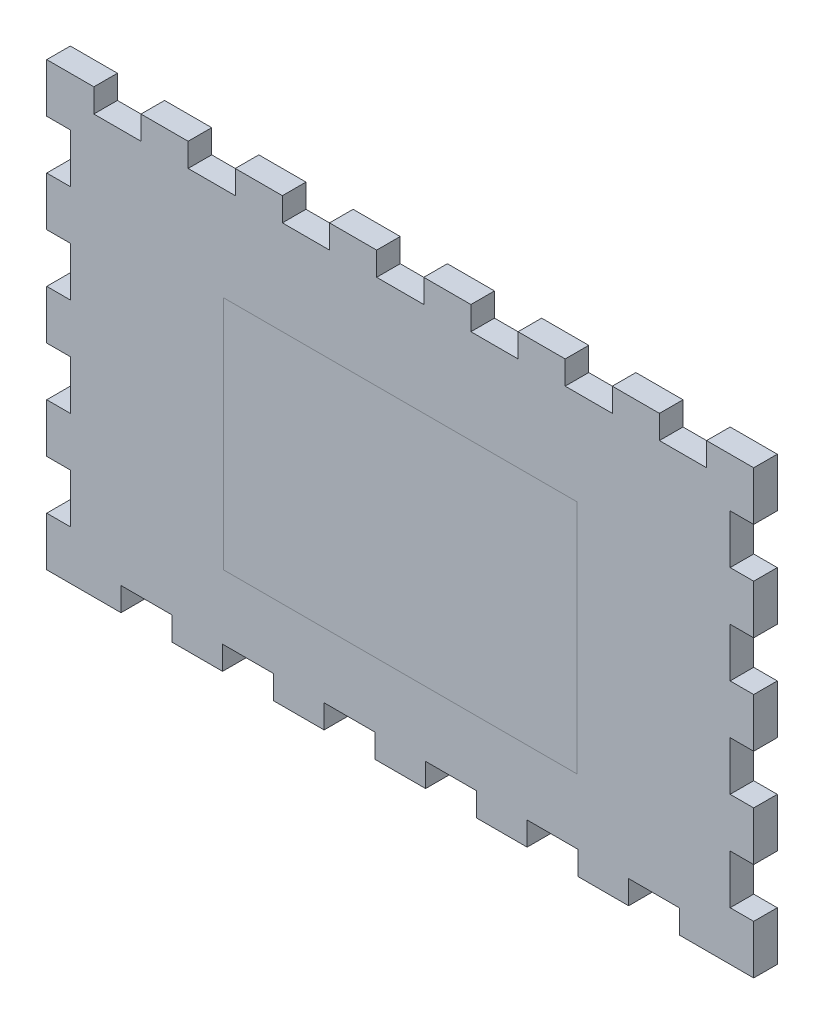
SolidWorks part; units mm, degrees
ref_plane "Front Plane" through (0, 0, 0) normal (0, 0, 1) x (1, 0, 0)
ref_plane "Top Plane" through (0, 0, 0) normal (0, 1, 0) x (1, 0, 0)
ref_plane "Right Plane" through (0, 0, 0) normal (1, 0, 0) x (0, 0, -1)
sketch "Model" plane through (0, 0, 0) normal (0, 0, 1) x (1, 0, 0)
  line L0 (83, 83) -> (87, 83)
  line L1 (87, 83) -> (87, 79)
  line L2 (87, 79) -> (95, 79)
  line L3 (95, 79) -> (95, 83)
  line L4 (95, 83) -> (103, 83)
  line L5 (103, 83) -> (103, 79)
  line L6 (103, 79) -> (111, 79)
  line L7 (111, 79) -> (111, 83)
  line L8 (111, 83) -> (119, 83)
  line L9 (119, 83) -> (119, 79)
  line L10 (119, 79) -> (127, 79)
  line L11 (127, 79) -> (127, 83)
  line L12 (127, 83) -> (135, 83)
  line L13 (135, 83) -> (135, 79)
  line L14 (135, 79) -> (143, 79)
  line L15 (143, 79) -> (143, 83)
  line L16 (143, 83) -> (151, 83)
  line L17 (151, 83) -> (151, 79)
  line L18 (151, 79) -> (159, 79)
  line L19 (159, 79) -> (159, 83)
  line L20 (159, 83) -> (167, 83)
  line L21 (167, 83) -> (167, 79)
  line L22 (167, 79) -> (175, 79)
  line L23 (175, 79) -> (175, 83)
  line L24 (175, 83) -> (183, 83)
  line L25 (183, 83) -> (183, 79)
  line L26 (183, 79) -> (191, 79)
  line L27 (191, 79) -> (191, 83)
  line L28 (191, 83) -> (195, 83)
  line L29 (195, 83) -> (195, 91.61)
  line L30 (195, 91.61) -> (199, 91.61)
  line L31 (199, 91.61) -> (199, 100.23)
  line L32 (199, 100.23) -> (195, 100.23)
  line L33 (195, 100.23) -> (195, 108.85)
  line L34 (195, 108.85) -> (199, 108.85)
  line L35 (199, 108.85) -> (199, 117.46)
  line L36 (199, 117.46) -> (195, 117.46)
  line L37 (195, 117.46) -> (195, 126.08)
  line L38 (195, 126.08) -> (199, 126.08)
  line L39 (199, 126.08) -> (199, 134.69)
  line L40 (199, 134.69) -> (195, 134.69)
  line L41 (195, 134.69) -> (195, 143.31)
  line L42 (195, 143.31) -> (199, 143.31)
  line L43 (199, 143.31) -> (199, 151.92)
  line L44 (199, 151.92) -> (195, 151.92)
  line L45 (195, 151.92) -> (195, 160.54)
  line L46 (195, 160.54) -> (199, 160.54)
  line L47 (199, 160.54) -> (199, 169.15)
  line L48 (199, 169.15) -> (195, 169.15)
  line L49 (195, 169.15) -> (195, 177.77)
  line L50 (195, 177.77) -> (199, 177.77)
  line L51 (199, 177.77) -> (199, 186.38)
  line L52 (199, 186.38) -> (195, 186.38)
  line L53 (195, 186.38) -> (195, 195)
  line L54 (195, 195) -> (191, 195)
  line L55 (191, 195) -> (191, 199)
  line L56 (191, 199) -> (183, 199)
  line L57 (183, 199) -> (183, 195)
  line L58 (183, 195) -> (175, 195)
  line L59 (175, 195) -> (175, 199)
  line L60 (175, 199) -> (167, 199)
  line L61 (167, 199) -> (167, 195)
  line L62 (167, 195) -> (159, 195)
  line L63 (159, 195) -> (159, 199)
  line L64 (159, 199) -> (151, 199)
  line L65 (151, 199) -> (151, 195)
  line L66 (151, 195) -> (143, 195)
  line L67 (143, 195) -> (143, 199)
  line L68 (143, 199) -> (135, 199)
  line L69 (135, 199) -> (135, 195)
  line L70 (135, 195) -> (127, 195)
  line L71 (127, 195) -> (127, 199)
  line L72 (127, 199) -> (119, 199)
  line L73 (119, 199) -> (119, 195)
  line L74 (119, 195) -> (111, 195)
  line L75 (111, 195) -> (111, 199)
  line L76 (111, 199) -> (103, 199)
  line L77 (103, 199) -> (103, 195)
  line L78 (103, 195) -> (95, 195)
  line L79 (95, 195) -> (95, 199)
  line L80 (95, 199) -> (87, 199)
  line L81 (87, 199) -> (87, 195)
  line L82 (87, 195) -> (83, 195)
  line L83 (83, 195) -> (83, 186.38)
  line L84 (83, 186.38) -> (79, 186.38)
  line L85 (79, 186.38) -> (79, 177.77)
  line L86 (79, 177.77) -> (83, 177.77)
  line L87 (83, 177.77) -> (83, 169.15)
  line L88 (83, 169.15) -> (79, 169.15)
  line L89 (79, 169.15) -> (79, 160.54)
  line L90 (79, 160.54) -> (83, 160.54)
  line L91 (83, 160.54) -> (83, 151.92)
  line L92 (83, 151.92) -> (79, 151.92)
  line L93 (79, 151.92) -> (79, 143.31)
  line L94 (79, 143.31) -> (83, 143.31)
  line L95 (83, 143.31) -> (83, 134.69)
  line L96 (83, 134.69) -> (79, 134.69)
  line L97 (79, 134.69) -> (79, 126.08)
  line L98 (79, 126.08) -> (83, 126.08)
  line L99 (83, 126.08) -> (83, 117.46)
  line L100 (83, 117.46) -> (79, 117.46)
  line L101 (79, 117.46) -> (79, 108.85)
  line L102 (79, 108.85) -> (83, 108.85)
  line L103 (83, 108.85) -> (83, 100.23)
  line L104 (83, 100.23) -> (79, 100.23)
  line L105 (79, 100.23) -> (79, 91.61)
  line L106 (79, 91.61) -> (83, 91.61)
  line L107 (83, 91.61) -> (83, 83)
  line L108 (83, 0) -> (91.61, 0)
  line L109 (91.61, 0) -> (91.61, 4)
  line L110 (91.61, 4) -> (100.23, 4)
  line L111 (100.23, 4) -> (100.23, 0)
  line L112 (100.23, 0) -> (108.85, 0)
  line L113 (108.85, 0) -> (108.85, 4)
  line L114 (108.85, 4) -> (117.46, 4)
  line L115 (117.46, 4) -> (117.46, 0)
  line L116 (117.46, 0) -> (126.08, 0)
  line L117 (126.08, 0) -> (126.08, 4)
  line L118 (126.08, 4) -> (134.69, 4)
  line L119 (134.69, 4) -> (134.69, 0)
  line L120 (134.69, 0) -> (143.31, 0)
  line L121 (143.31, 0) -> (143.31, 4)
  line L122 (143.31, 4) -> (151.92, 4)
  line L123 (151.92, 4) -> (151.92, 0)
  line L124 (151.92, 0) -> (160.54, 0)
  line L125 (160.54, 0) -> (160.54, 4)
  line L126 (160.54, 4) -> (169.15, 4)
  line L127 (169.15, 4) -> (169.15, 0)
  line L128 (169.15, 0) -> (177.77, 0)
  line L129 (177.77, 0) -> (177.77, 4)
  line L130 (177.77, 4) -> (186.38, 4)
  line L131 (186.38, 4) -> (186.38, 0)
  line L132 (186.38, 0) -> (195, 0)
  line L133 (195, 0) -> (199, 0)
  line L134 (199, 0) -> (199, 8.33)
  line L135 (199, 8.33) -> (195, 8.33)
  line L136 (195, 8.33) -> (195, 16.67)
  line L137 (195, 16.67) -> (199, 16.67)
  line L138 (199, 16.67) -> (199, 25)
  line L139 (199, 25) -> (195, 25)
  line L140 (195, 25) -> (195, 33.33)
  line L141 (195, 33.33) -> (199, 33.33)
  line L142 (199, 33.33) -> (199, 41.67)
  line L143 (199, 41.67) -> (195, 41.67)
  line L144 (195, 41.67) -> (195, 50)
  line L145 (195, 50) -> (199, 50)
  line L146 (199, 50) -> (199, 58.33)
  line L147 (199, 58.33) -> (195, 58.33)
  line L148 (195, 58.33) -> (195, 66.67)
  line L149 (195, 66.67) -> (199, 66.67)
  line L150 (199, 66.67) -> (199, 75)
  line L151 (199, 75) -> (191, 75)
  line L152 (191, 75) -> (191, 71)
  line L153 (191, 71) -> (183, 71)
  line L154 (183, 71) -> (183, 75)
  line L155 (183, 75) -> (175, 75)
  line L156 (175, 75) -> (175, 71)
  line L157 (175, 71) -> (167, 71)
  line L158 (167, 71) -> (167, 75)
  line L159 (167, 75) -> (159, 75)
  line L160 (159, 75) -> (159, 71)
  line L161 (159, 71) -> (151, 71)
  line L162 (151, 71) -> (151, 75)
  line L163 (151, 75) -> (143, 75)
  line L164 (143, 75) -> (143, 71)
  line L165 (143, 71) -> (135, 71)
  line L166 (135, 71) -> (135, 75)
  line L167 (135, 75) -> (127, 75)
  line L168 (127, 75) -> (127, 71)
  line L169 (127, 71) -> (119, 71)
  line L170 (119, 71) -> (119, 75)
  line L171 (119, 75) -> (111, 75)
  line L172 (111, 75) -> (111, 71)
  line L173 (111, 71) -> (103, 71)
  line L174 (103, 71) -> (103, 75)
  line L175 (103, 75) -> (95, 75)
  line L176 (95, 75) -> (95, 71)
  line L177 (95, 71) -> (87, 71)
  line L178 (87, 71) -> (87, 75)
  line L179 (87, 75) -> (79, 75)
  line L180 (79, 75) -> (79, 66.67)
  line L181 (79, 66.67) -> (83, 66.67)
  line L182 (83, 66.67) -> (83, 58.33)
  line L183 (83, 58.33) -> (79, 58.33)
  line L184 (79, 58.33) -> (79, 50)
  line L185 (79, 50) -> (83, 50)
  line L186 (83, 50) -> (83, 41.67)
  line L187 (83, 41.67) -> (79, 41.67)
  line L188 (79, 41.67) -> (79, 33.33)
  line L189 (79, 33.33) -> (83, 33.33)
  line L190 (83, 33.33) -> (83, 25)
  line L191 (83, 25) -> (79, 25)
  line L192 (79, 25) -> (79, 16.67)
  line L193 (79, 16.67) -> (83, 16.67)
  line L194 (83, 16.67) -> (83, 8.33)
  line L195 (83, 8.33) -> (79, 8.33)
  line L196 (79, 8.33) -> (79, 0)
  line L197 (79, 0) -> (83, 0)
  line L198 (83, 278) -> (91.61, 278)
  line L199 (91.61, 278) -> (91.61, 274)
  line L200 (91.61, 274) -> (100.23, 274)
  line L201 (100.23, 274) -> (100.23, 278)
  line L202 (100.23, 278) -> (108.85, 278)
  line L203 (108.85, 278) -> (108.85, 274)
  line L204 (108.85, 274) -> (117.46, 274)
  line L205 (117.46, 274) -> (117.46, 278)
  line L206 (117.46, 278) -> (126.08, 278)
  line L207 (126.08, 278) -> (126.08, 274)
  line L208 (126.08, 274) -> (134.69, 274)
  line L209 (134.69, 274) -> (134.69, 278)
  line L210 (134.69, 278) -> (143.31, 278)
  line L211 (143.31, 278) -> (143.31, 274)
  line L212 (143.31, 274) -> (151.92, 274)
  line L213 (151.92, 274) -> (151.92, 278)
  line L214 (151.92, 278) -> (160.54, 278)
  line L215 (160.54, 278) -> (160.54, 274)
  line L216 (160.54, 274) -> (169.15, 274)
  line L217 (169.15, 274) -> (169.15, 278)
  line L218 (169.15, 278) -> (177.77, 278)
  line L219 (177.77, 278) -> (177.77, 274)
  line L220 (177.77, 274) -> (186.38, 274)
  line L221 (186.38, 274) -> (186.38, 278)
  line L222 (186.38, 278) -> (195, 278)
  line L223 (195, 278) -> (199, 278)
  line L224 (199, 278) -> (199, 269.67)
  line L225 (199, 269.67) -> (195, 269.67)
  line L226 (195, 269.67) -> (195, 261.33)
  line L227 (195, 261.33) -> (199, 261.33)
  line L228 (199, 261.33) -> (199, 253)
  line L229 (199, 253) -> (195, 253)
  line L230 (195, 253) -> (195, 244.67)
  line L231 (195, 244.67) -> (199, 244.67)
  line L232 (199, 244.67) -> (199, 236.33)
  line L233 (199, 236.33) -> (195, 236.33)
  line L234 (195, 236.33) -> (195, 228)
  line L235 (195, 228) -> (199, 228)
  line L236 (199, 228) -> (199, 219.67)
  line L237 (199, 219.67) -> (195, 219.67)
  line L238 (195, 219.67) -> (195, 211.33)
  line L239 (195, 211.33) -> (199, 211.33)
  line L240 (199, 211.33) -> (199, 203)
  line L241 (199, 203) -> (191, 203)
  line L242 (191, 203) -> (191, 207)
  line L243 (191, 207) -> (183, 207)
  line L244 (183, 207) -> (183, 203)
  line L245 (183, 203) -> (175, 203)
  line L246 (175, 203) -> (175, 207)
  line L247 (175, 207) -> (167, 207)
  line L248 (167, 207) -> (167, 203)
  line L249 (167, 203) -> (159, 203)
  line L250 (159, 203) -> (159, 207)
  line L251 (159, 207) -> (151, 207)
  line L252 (151, 207) -> (151, 203)
  line L253 (151, 203) -> (143, 203)
  line L254 (143, 203) -> (143, 207)
  line L255 (143, 207) -> (135, 207)
  line L256 (135, 207) -> (135, 203)
  line L257 (135, 203) -> (127, 203)
  line L258 (127, 203) -> (127, 207)
  line L259 (127, 207) -> (119, 207)
  line L260 (119, 207) -> (119, 203)
  line L261 (119, 203) -> (111, 203)
  line L262 (111, 203) -> (111, 207)
  line L263 (111, 207) -> (103, 207)
  line L264 (103, 207) -> (103, 203)
  line L265 (103, 203) -> (95, 203)
  line L266 (95, 203) -> (95, 207)
  line L267 (95, 207) -> (87, 207)
  line L268 (87, 207) -> (87, 203)
  line L269 (87, 203) -> (79, 203)
  line L270 (79, 203) -> (79, 211.33)
  line L271 (79, 211.33) -> (83, 211.33)
  line L272 (83, 211.33) -> (83, 219.67)
  line L273 (83, 219.67) -> (79, 219.67)
  line L274 (79, 219.67) -> (79, 228)
  line L275 (79, 228) -> (83, 228)
  line L276 (83, 228) -> (83, 236.33)
  line L277 (83, 236.33) -> (79, 236.33)
  line L278 (79, 236.33) -> (79, 244.67)
  line L279 (79, 244.67) -> (83, 244.67)
  line L280 (83, 244.67) -> (83, 253)
  line L281 (83, 253) -> (79, 253)
  line L282 (79, 253) -> (79, 261.33)
  line L283 (79, 261.33) -> (83, 261.33)
  line L284 (83, 261.33) -> (83, 269.67)
  line L285 (83, 269.67) -> (79, 269.67)
  line L286 (79, 269.67) -> (79, 278)
  line L287 (79, 278) -> (83, 278)
  line L288 (0, 83) -> (0, 91.61)
  line L289 (0, 91.61) -> (4, 91.61)
  line L290 (4, 91.61) -> (4, 100.23)
  line L291 (4, 100.23) -> (0, 100.23)
  line L292 (0, 100.23) -> (0, 108.85)
  line L293 (0, 108.85) -> (4, 108.85)
  line L294 (4, 108.85) -> (4, 117.46)
  line L295 (4, 117.46) -> (0, 117.46)
  line L296 (0, 117.46) -> (0, 126.08)
  line L297 (0, 126.08) -> (4, 126.08)
  line L298 (4, 126.08) -> (4, 134.69)
  line L299 (4, 134.69) -> (0, 134.69)
  line L300 (0, 134.69) -> (0, 143.31)
  line L301 (0, 143.31) -> (4, 143.31)
  line L302 (4, 143.31) -> (4, 151.92)
  line L303 (4, 151.92) -> (0, 151.92)
  line L304 (0, 151.92) -> (0, 160.54)
  line L305 (0, 160.54) -> (4, 160.54)
  line L306 (4, 160.54) -> (4, 169.15)
  line L307 (4, 169.15) -> (0, 169.15)
  line L308 (0, 169.15) -> (0, 177.77)
  line L309 (0, 177.77) -> (4, 177.77)
  line L310 (4, 177.77) -> (4, 186.38)
  line L311 (4, 186.38) -> (0, 186.38)
  line L312 (0, 186.38) -> (0, 195)
  line L313 (0, 195) -> (8.33, 195)
  line L314 (8.33, 195) -> (8.33, 199)
  line L315 (8.33, 199) -> (16.67, 199)
  line L316 (16.67, 199) -> (16.67, 195)
  line L317 (16.67, 195) -> (25, 195)
  line L318 (25, 195) -> (25, 199)
  line L319 (25, 199) -> (33.33, 199)
  line L320 (33.33, 199) -> (33.33, 195)
  line L321 (33.33, 195) -> (41.67, 195)
  line L322 (41.67, 195) -> (41.67, 199)
  line L323 (41.67, 199) -> (50, 199)
  line L324 (50, 199) -> (50, 195)
  line L325 (50, 195) -> (58.33, 195)
  line L326 (58.33, 195) -> (58.33, 199)
  line L327 (58.33, 199) -> (66.67, 199)
  line L328 (66.67, 199) -> (66.67, 195)
  line L329 (66.67, 195) -> (75, 195)
  line L330 (75, 195) -> (75, 186.38)
  line L331 (75, 186.38) -> (71, 186.38)
  line L332 (71, 186.38) -> (71, 177.77)
  line L333 (71, 177.77) -> (75, 177.77)
  line L334 (75, 177.77) -> (75, 169.15)
  line L335 (75, 169.15) -> (71, 169.15)
  line L336 (71, 169.15) -> (71, 160.54)
  line L337 (71, 160.54) -> (75, 160.54)
  line L338 (75, 160.54) -> (75, 151.92)
  line L339 (75, 151.92) -> (71, 151.92)
  line L340 (71, 151.92) -> (71, 143.31)
  line L341 (71, 143.31) -> (75, 143.31)
  line L342 (75, 143.31) -> (75, 134.69)
  line L343 (75, 134.69) -> (71, 134.69)
  line L344 (71, 134.69) -> (71, 126.08)
  line L345 (71, 126.08) -> (75, 126.08)
  line L346 (75, 126.08) -> (75, 117.46)
  line L347 (75, 117.46) -> (71, 117.46)
  line L348 (71, 117.46) -> (71, 108.85)
  line L349 (71, 108.85) -> (75, 108.85)
  line L350 (75, 108.85) -> (75, 100.23)
  line L351 (75, 100.23) -> (71, 100.23)
  line L352 (71, 100.23) -> (71, 91.61)
  line L353 (71, 91.61) -> (75, 91.61)
  line L354 (75, 91.61) -> (75, 83)
  line L355 (75, 83) -> (66.67, 83)
  line L356 (66.67, 83) -> (66.67, 79)
  line L357 (66.67, 79) -> (58.33, 79)
  line L358 (58.33, 79) -> (58.33, 83)
  line L359 (58.33, 83) -> (50, 83)
  line L360 (50, 83) -> (50, 79)
  line L361 (50, 79) -> (41.67, 79)
  line L362 (41.67, 79) -> (41.67, 83)
  line L363 (41.67, 83) -> (33.33, 83)
  line L364 (33.33, 83) -> (33.33, 79)
  line L365 (33.33, 79) -> (25, 79)
  line L366 (25, 79) -> (25, 83)
  line L367 (25, 83) -> (16.67, 83)
  line L368 (16.67, 83) -> (16.67, 79)
  line L369 (16.67, 79) -> (8.33, 79)
  line L370 (8.33, 79) -> (8.33, 83)
  line L371 (8.33, 83) -> (0, 83)
  line L372 (278, 83) -> (278, 91.61)
  line L373 (278, 91.61) -> (274, 91.61)
  line L374 (274, 91.61) -> (274, 100.23)
  line L375 (274, 100.23) -> (278, 100.23)
  line L376 (278, 100.23) -> (278, 108.85)
  line L377 (278, 108.85) -> (274, 108.85)
  line L378 (274, 108.85) -> (274, 117.46)
  line L379 (274, 117.46) -> (278, 117.46)
  line L380 (278, 117.46) -> (278, 126.08)
  line L381 (278, 126.08) -> (274, 126.08)
  line L382 (274, 126.08) -> (274, 134.69)
  line L383 (274, 134.69) -> (278, 134.69)
  line L384 (278, 134.69) -> (278, 143.31)
  line L385 (278, 143.31) -> (274, 143.31)
  line L386 (274, 143.31) -> (274, 151.92)
  line L387 (274, 151.92) -> (278, 151.92)
  line L388 (278, 151.92) -> (278, 160.54)
  line L389 (278, 160.54) -> (274, 160.54)
  line L390 (274, 160.54) -> (274, 169.15)
  line L391 (274, 169.15) -> (278, 169.15)
  line L392 (278, 169.15) -> (278, 177.77)
  line L393 (278, 177.77) -> (274, 177.77)
  line L394 (274, 177.77) -> (274, 186.38)
  line L395 (274, 186.38) -> (278, 186.38)
  line L396 (278, 186.38) -> (278, 195)
  line L397 (278, 195) -> (269.67, 195)
  line L398 (269.67, 195) -> (269.67, 199)
  line L399 (269.67, 199) -> (261.33, 199)
  line L400 (261.33, 199) -> (261.33, 195)
  line L401 (261.33, 195) -> (253, 195)
  line L402 (253, 195) -> (253, 199)
  line L403 (253, 199) -> (244.67, 199)
  line L404 (244.67, 199) -> (244.67, 195)
  line L405 (244.67, 195) -> (236.33, 195)
  line L406 (236.33, 195) -> (236.33, 199)
  line L407 (236.33, 199) -> (228, 199)
  line L408 (228, 199) -> (228, 195)
  line L409 (228, 195) -> (219.67, 195)
  line L410 (219.67, 195) -> (219.67, 199)
  line L411 (219.67, 199) -> (211.33, 199)
  line L412 (211.33, 199) -> (211.33, 195)
  line L413 (211.33, 195) -> (203, 195)
  line L414 (203, 195) -> (203, 186.38)
  line L415 (203, 186.38) -> (207, 186.38)
  line L416 (207, 186.38) -> (207, 177.77)
  line L417 (207, 177.77) -> (203, 177.77)
  line L418 (203, 177.77) -> (203, 169.15)
  line L419 (203, 169.15) -> (207, 169.15)
  line L420 (207, 169.15) -> (207, 160.54)
  line L421 (207, 160.54) -> (203, 160.54)
  line L422 (203, 160.54) -> (203, 151.92)
  line L423 (203, 151.92) -> (207, 151.92)
  line L424 (207, 151.92) -> (207, 143.31)
  line L425 (207, 143.31) -> (203, 143.31)
  line L426 (203, 143.31) -> (203, 134.69)
  line L427 (203, 134.69) -> (207, 134.69)
  line L428 (207, 134.69) -> (207, 126.08)
  line L429 (207, 126.08) -> (203, 126.08)
  line L430 (203, 126.08) -> (203, 117.46)
  line L431 (203, 117.46) -> (207, 117.46)
  line L432 (207, 117.46) -> (207, 108.85)
  line L433 (207, 108.85) -> (203, 108.85)
  line L434 (203, 108.85) -> (203, 100.23)
  line L435 (203, 100.23) -> (207, 100.23)
  line L436 (207, 100.23) -> (207, 91.61)
  line L437 (207, 91.61) -> (203, 91.61)
  line L438 (203, 91.61) -> (203, 83)
  line L439 (203, 83) -> (211.33, 83)
  line L440 (211.33, 83) -> (211.33, 79)
  line L441 (211.33, 79) -> (219.67, 79)
  line L442 (219.67, 79) -> (219.67, 83)
  line L443 (219.67, 83) -> (228, 83)
  line L444 (228, 83) -> (228, 79)
  line L445 (228, 79) -> (236.33, 79)
  line L446 (236.33, 79) -> (236.33, 83)
  line L447 (236.33, 83) -> (244.67, 83)
  line L448 (244.67, 83) -> (244.67, 79)
  line L449 (244.67, 79) -> (253, 79)
  line L450 (253, 79) -> (253, 83)
  line L451 (253, 83) -> (261.33, 83)
  line L452 (261.33, 83) -> (261.33, 79)
  line L453 (261.33, 79) -> (269.67, 79)
  line L454 (269.67, 79) -> (269.67, 83)
  line L455 (269.67, 83) -> (278, 83)
  line L456 (83, 286) -> (91.61, 286)
  line L457 (91.61, 286) -> (91.61, 282)
  line L458 (91.61, 282) -> (100.23, 282)
  line L459 (100.23, 282) -> (100.23, 286)
  line L460 (100.23, 286) -> (108.85, 286)
  line L461 (108.85, 286) -> (108.85, 282)
  line L462 (108.85, 282) -> (117.46, 282)
  line L463 (117.46, 282) -> (117.46, 286)
  line L464 (117.46, 286) -> (126.08, 286)
  line L465 (126.08, 286) -> (126.08, 282)
  line L466 (126.08, 282) -> (134.69, 282)
  line L467 (134.69, 282) -> (134.69, 286)
  line L468 (134.69, 286) -> (143.31, 286)
  line L469 (143.31, 286) -> (143.31, 282)
  line L470 (143.31, 282) -> (151.92, 282)
  line L471 (151.92, 282) -> (151.92, 286)
  line L472 (151.92, 286) -> (160.54, 286)
  line L473 (160.54, 286) -> (160.54, 282)
  line L474 (160.54, 282) -> (169.15, 282)
  line L475 (169.15, 282) -> (169.15, 286)
  line L476 (169.15, 286) -> (177.77, 286)
  line L477 (177.77, 286) -> (177.77, 282)
  line L478 (177.77, 282) -> (186.38, 282)
  line L479 (186.38, 282) -> (186.38, 286)
  line L480 (186.38, 286) -> (195, 286)
  line L481 (195, 286) -> (195, 294.62)
  line L482 (195, 294.62) -> (199, 294.62)
  line L483 (199, 294.62) -> (199, 303.23)
  line L484 (199, 303.23) -> (195, 303.23)
  line L485 (195, 303.23) -> (195, 311.85)
  line L486 (195, 311.85) -> (199, 311.85)
  line L487 (199, 311.85) -> (199, 320.46)
  line L488 (199, 320.46) -> (195, 320.46)
  line L489 (195, 320.46) -> (195, 329.08)
  line L490 (195, 329.08) -> (199, 329.08)
  line L491 (199, 329.08) -> (199, 337.69)
  line L492 (199, 337.69) -> (195, 337.69)
  line L493 (195, 337.69) -> (195, 346.31)
  line L494 (195, 346.31) -> (199, 346.31)
  line L495 (199, 346.31) -> (199, 354.92)
  line L496 (199, 354.92) -> (195, 354.92)
  line L497 (195, 354.92) -> (195, 363.54)
  line L498 (195, 363.54) -> (199, 363.54)
  line L499 (199, 363.54) -> (199, 372.15)
  line L500 (199, 372.15) -> (195, 372.15)
  line L501 (195, 372.15) -> (195, 380.77)
  line L502 (195, 380.77) -> (199, 380.77)
  line L503 (199, 380.77) -> (199, 389.38)
  line L504 (199, 389.38) -> (195, 389.38)
  line L505 (195, 389.38) -> (195, 398)
  line L506 (195, 398) -> (186.38, 398)
  line L507 (186.38, 398) -> (186.38, 402)
  line L508 (186.38, 402) -> (177.77, 402)
  line L509 (177.77, 402) -> (177.77, 398)
  line L510 (177.77, 398) -> (169.15, 398)
  line L511 (169.15, 398) -> (169.15, 402)
  line L512 (169.15, 402) -> (160.54, 402)
  line L513 (160.54, 402) -> (160.54, 398)
  line L514 (160.54, 398) -> (151.92, 398)
  line L515 (151.92, 398) -> (151.92, 402)
  line L516 (151.92, 402) -> (143.31, 402)
  line L517 (143.31, 402) -> (143.31, 398)
  line L518 (143.31, 398) -> (134.69, 398)
  line L519 (134.69, 398) -> (134.69, 402)
  line L520 (134.69, 402) -> (126.08, 402)
  line L521 (126.08, 402) -> (126.08, 398)
  line L522 (126.08, 398) -> (117.46, 398)
  line L523 (117.46, 398) -> (117.46, 402)
  line L524 (117.46, 402) -> (108.85, 402)
  line L525 (108.85, 402) -> (108.85, 398)
  line L526 (108.85, 398) -> (100.23, 398)
  line L527 (100.23, 398) -> (100.23, 402)
  line L528 (100.23, 402) -> (91.61, 402)
  line L529 (91.61, 402) -> (91.61, 398)
  line L530 (91.61, 398) -> (83, 398)
  line L531 (83, 398) -> (83, 389.38)
  line L532 (83, 389.38) -> (79, 389.38)
  line L533 (79, 389.38) -> (79, 380.77)
  line L534 (79, 380.77) -> (83, 380.77)
  line L535 (83, 380.77) -> (83, 372.15)
  line L536 (83, 372.15) -> (79, 372.15)
  line L537 (79, 372.15) -> (79, 363.54)
  line L538 (79, 363.54) -> (83, 363.54)
  line L539 (83, 363.54) -> (83, 354.92)
  line L540 (83, 354.92) -> (79, 354.92)
  line L541 (79, 354.92) -> (79, 346.31)
  line L542 (79, 346.31) -> (83, 346.31)
  line L543 (83, 346.31) -> (83, 337.69)
  line L544 (83, 337.69) -> (79, 337.69)
  line L545 (79, 337.69) -> (79, 329.08)
  line L546 (79, 329.08) -> (83, 329.08)
  line L547 (83, 329.08) -> (83, 320.46)
  line L548 (83, 320.46) -> (79, 320.46)
  line L549 (79, 320.46) -> (79, 311.85)
  line L550 (79, 311.85) -> (83, 311.85)
  line L551 (83, 311.85) -> (83, 303.23)
  line L552 (83, 303.23) -> (79, 303.23)
  line L553 (79, 303.23) -> (79, 294.62)
  line L554 (79, 294.62) -> (83, 294.62)
  line L555 (83, 294.62) -> (83, 286)
extrude "Boss-Extrude1" add sketch "Model" along normal blind 4 contours L196 L197 L108 L109 L110 L111 L112 L113 L114 L115 L116 L117 L118 L119 L120 L121 L122 L123 L124 L125 L126 L127 L128 L129 L130 L131 L132 L133 L134 L135 L136 L137 L138 L139 L140 L141 L142 L143 L144 L145 L146 L147 L148 L149 L150 L151 L152 L153 L154 L155 L156
sketch "Sketch1" plane through (0, 0, 4) normal (0, 0, 1) x (1, 0, 0)
  line L0 (135, 75) -> (127, 75) construction
  line L1 (109, 55) -> (169, 55)
  line L2 (109, 55) -> (109, 15)
  line L3 (109, 15) -> (169, 15)
  line L4 (169, 55) -> (169, 15)
  line L5 (199, 50) -> (199, 58.33) construction
  dimension "D1" = 40
  dimension "D2" = 60
  dimension "D3" = 20
  dimension "D4" = 30
